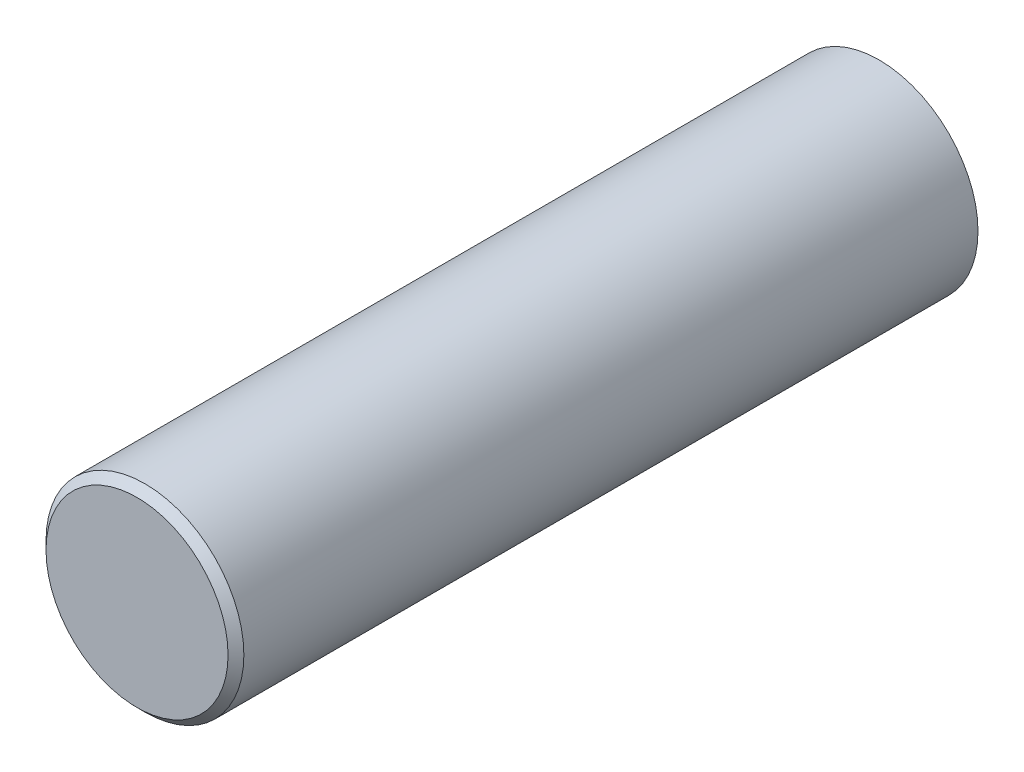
SolidWorks part; units mm, degrees
ref_plane "Plan de face" through (0, 0, 0) normal (0, 0, 1) x (1, 0, 0)
ref_plane "Plan de dessus" through (0, 0, 0) normal (0, 1, 0) x (1, 0, 0)
ref_plane "Plan de droite" through (0, 0, 0) normal (1, 0, 0) x (0, 0, -1)
sketch "Esquisse1" plane through (0, 0, 0) normal (0, 0, 1) x (1, 0, 0)
  circle A0 centre (0, 0) radius 10
  dimension "D1" = 20
extrude "Extrusion1" add sketch "Esquisse1" along normal blind 75
chamfer "Chanfrein1" distance 0.8 angle 45 1 edges at (10, 0, 75)
